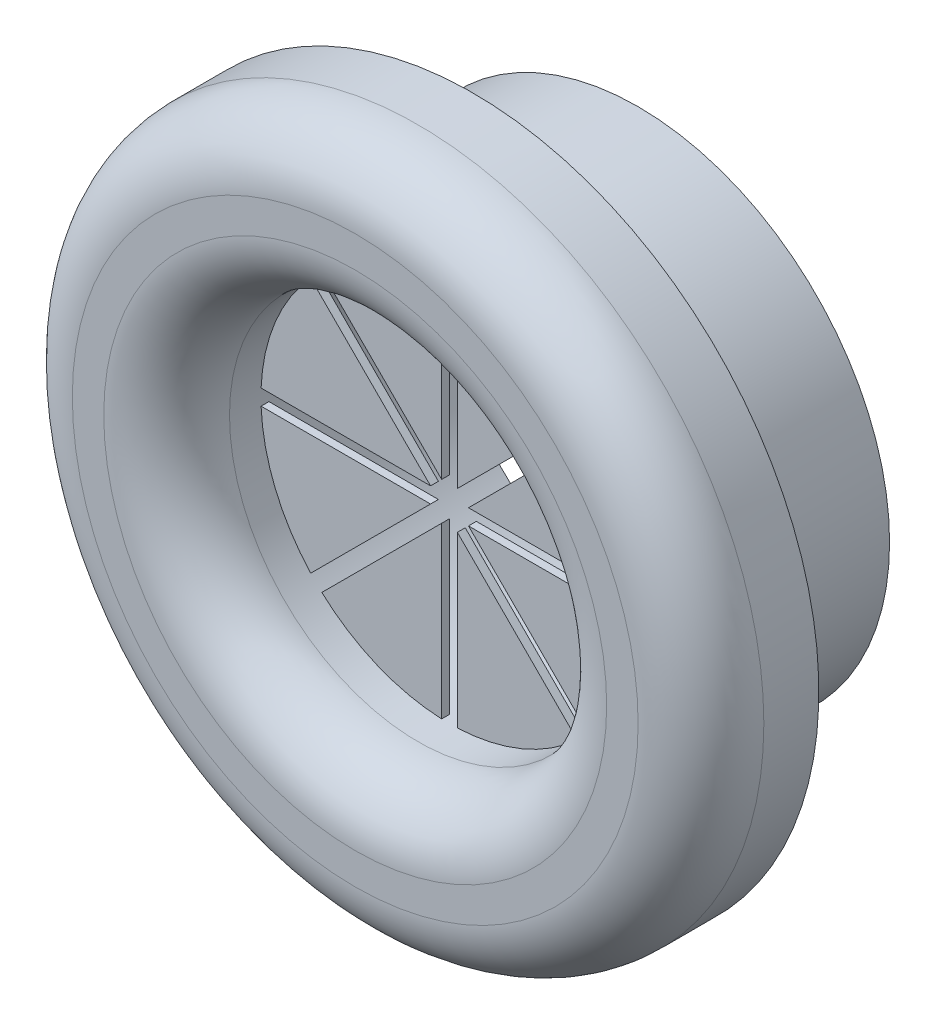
SolidWorks part; units mm, degrees
ref_plane "Płaszczyzna przednia" through (0, 0, 0) normal (0, 0, 1) x (1, 0, 0)
ref_plane "Płaszczyzna górna" through (0, 0, 0) normal (0, 1, 0) x (1, 0, 0)
ref_plane "Płaszczyzna prawa" through (0, 0, 0) normal (1, 0, 0) x (0, 0, -1)
sketch "Szkic1" plane through (0, 0, 0) normal (0, 0, 1) x (1, 0, 0)
  circle A0 centre (0, 0) radius 8
extrude "Dodanie-wyciągnięcie1" add sketch "Szkic1" along normal blind 5
sketch "Szkic2" plane through (0, 0, 5) normal (0, 0, 1) x (1, 0, 0)
  circle A0 centre (0, 0) radius 11
extrude "Dodanie-wyciągnięcie2" add sketch "Szkic2" along normal blind 4
sketch "Szkic3" plane through (0, 0, 9) normal (0, 0, 1) x (1, 0, 0)
  circle A0 centre (0, 0) radius 6
extrude "Wytnij-wyciągnięcie1" cut sketch "Szkic3" against normal through all
fillet "Zaokrąglenie1" radius 2 2 edges at (6, 0, 9) (11, 0, 9)
ref_plane "Płaszczyzna1" through (0, 0, 6) normal (0, 0, -1) x (-1, 0, 0)
sketch "Szkic4" plane through (0, 0, 6) normal (0, 0, -1) x (-1, 0, 0)
  line L0 (4.4157, -4.0622) -> (0.6036, -0.25)
  line L9 (5.9948, -0.25) -> (0.6036, -0.25) construction
  line L11 (0.6036, -0.25) -> (5.9948, -0.25)
  arc A1 (4.4157, -4.0622) -> (5.9948, -0.25) centre (0, 0) ccw
extrude "Dodanie-wyciągnięcie3" add sketch "Szkic4" along normal blind 0.25 contours L11 A1 L0
pattern_circular "Szyk kołowy1" count 8 over 360 about axis through (0, 0, 0) along (0, 0, 1) of "Dodanie-wyciągnięcie3"
sketch "Szkic5" plane through (0, 0, 5) normal (0, 0, -1) x (-1, 0, 0)
  circle A0 centre (0, 0) radius 10
  circle A1 centre (0, 0) radius 11
extrude "Wytnij-wyciągnięcie2" cut sketch "Szkic5" against normal blind 0.25
